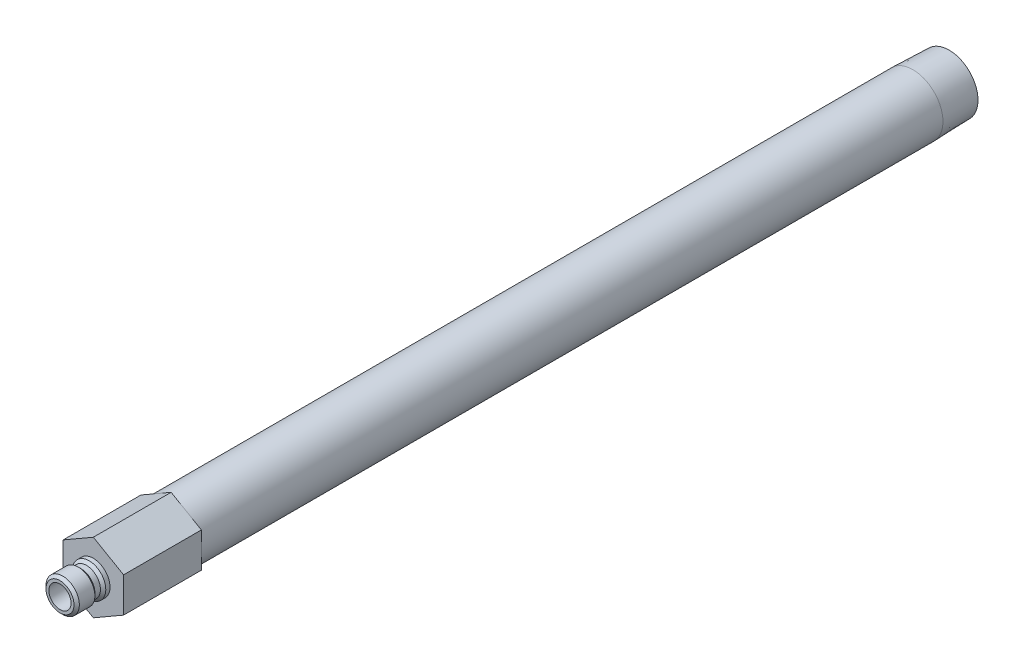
SolidWorks part; units mm, degrees
ref_plane "Front Plane" through (0, 0, 0) normal (0, 0, 1) x (1, 0, 0)
ref_plane "Top Plane" through (0, 0, 0) normal (0, 1, 0) x (1, 0, 0)
ref_plane "Right Plane" through (0, 0, 0) normal (1, 0, 0) x (0, 0, -1)
sketch "Sketch1" plane through (0, 0, 0) normal (1, 0, 0) x (0, 0, -1)
  line L0 (0, 0) -> (-12.7, 0) construction
  line L1 (-9.525, 3.175) -> (-9.525, 4.0005)
  line L2 (-3.556, 4.0005) -> (-3.556, 0) construction
  line L3 (-8.763, 4.7625) -> (-4.318, 4.7625)
  line L4 (0, 8.5725) -> (0, 0) construction
  line L5 (-3.556, 4.0005) -> (-1.9685, 4.0005)
  line L6 (-1.2065, 4.7625) -> (0, 4.7625)
  line L7 (0, 4.7625) -> (0, 8.5725)
  line L8 (-3.556, 4.0005) -> (-4.318, 4.7625)
  line L9 (-1.9685, 4.0005) -> (-1.2065, 4.7625)
  line L10 (-9.525, 4.0005) -> (-8.763, 4.7625)
  line L11 (-9.525, 3.175) -> (22.225, 3.175)
  line L12 (0, 8.5725) -> (234.1372, 8.5725)
  line L13 (234.1372, 8.5725) -> (244.475, 8.2494)
  line L14 (244.475, 8.2494) -> (244.475, 6.2611)
  line L15 (0, 0) -> (22.225, 0) construction
  line L16 (22.225, 0) -> (22.225, 3.175) construction
  line L17 (22.225, 4.7625) -> (0, 4.7625) construction
  line L18 (22.225, 3.175) -> (22.225, 6.2611)
  line L19 (22.225, 6.2611) -> (244.475, 6.2611)
  line L20 (22.225, 3.175) -> (22.225, 4.7625) construction
  dimension "D1" = 9.525
  dimension "D2" = 1.5875
  dimension "D3" = 0.762
  dimension "D4" = 45
  dimension "D5" = 5.969
  dimension "D6" = 45
  dimension "D7" = 1.79
  dimension "D8" = 10.3378
  dimension "D9" = 254
  dimension "D10" = 3.175
  dimension "D11" = 31.75
  dimension "D12" = 6.35
  dimension "D13" = 12.5222
  dimension "D14" = 9.525
  dimension "D15" = 17.145
revolve "Revolve1" add sketch "Sketch1" angle 360 about L0
sketch "Sketch2" plane through (0, 0, 0) normal (0, 0, 1) x (1, 0, 0)
  line L1 (-8.636, 4.986) -> (-8.636, -4.986)
  line L2 (-8.636, -4.986) -> (0, -9.972)
  line L3 (0, -9.972) -> (8.636, -4.986)
  line L4 (8.636, -4.986) -> (8.636, 4.986)
  line L5 (8.636, 4.986) -> (0, 9.972)
  line L6 (0, 9.972) -> (-8.636, 4.986)
  circle A0 centre (0, 0) radius 8.636 construction
  circle A1 centre (0, 0) radius 3.175 construction
  circle A2 centre (0, 0) radius 3.175
  dimension "D1" = 17.272
extrude "Boss-Extrude1" add sketch "Sketch2" against normal up to vertex (22.225 mm away) from vertex at 0
